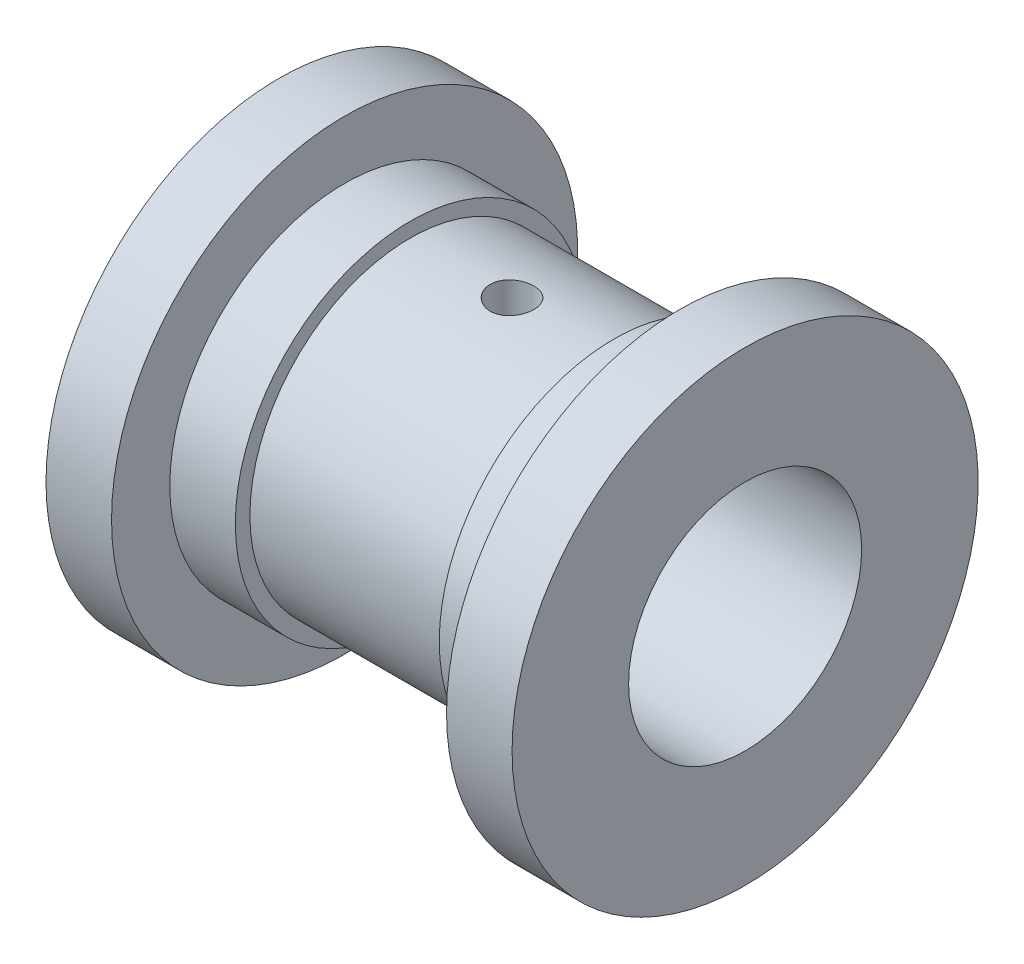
SolidWorks part; units mm, degrees
ref_plane "Front" through (0, 0, 0) normal (0, 0, 1) x (1, 0, 0)
ref_plane "Top" through (0, 0, 0) normal (0, 1, 0) x (1, 0, 0)
ref_plane "Right" through (0, 0, 0) normal (1, 0, 0) x (0, 0, -1)
sketch "Sketch1" plane through (0, 0, 0) normal (0, 0, 1) x (1, 0, 0)
  line L0 (-34.2237, 0) -> (34.9718, 0) construction
  line L1 (-32, 16) -> (-32, 32)
  line L2 (-32, 32) -> (-23, 32)
  line L3 (-23, 32) -> (-23, 24)
  line L4 (-23, 24) -> (-14, 24)
  line L5 (-14, 24) -> (-14, 22)
  line L6 (-14, 22) -> (14, 22)
  line L7 (0, 0) -> (0, 21.1327) construction
  line L8 (14, 24) -> (14, 22)
  line L9 (23, 24) -> (14, 24)
  line L10 (23, 32) -> (23, 24)
  line L11 (32, 32) -> (23, 32)
  line L12 (32, 16) -> (32, 32)
  line L13 (-32, 16) -> (32, 16)
  point P13 (0, 22)
  dimension "D1" = 44
  dimension "D2" = 48
  dimension "D3" = 64
  dimension "D4" = 32
  dimension "D5" = 28
  dimension "D6" = 46
  dimension "D7" = 9
revolve "Revolve1" add sketch "Sketch1" angle 360 about L0
ref_plane "Plane1" through (0, -30, 0) normal (0, 1, 0) x (-1, 0, 0)
sketch "Sketch3" plane through (0, -30, 0) normal (0, 1, 0) x (-1, 0, 0)
  circle A0 centre (0, 0) radius 4
  dimension "D1" = 8
extrude "Extrude1" add sketch "Sketch3" along normal up to next
sketch "Sketch4" plane through (0, -30, 0) normal (0, -1, 0) x (1, 0, 0)
  point P0 (0, 0)
other "Hole1"
sketch "Sketch5" plane through (0, -30, 0) normal (0, -1, 0) x (1, 0, 0)
  circle A0 centre (0, 0) radius 3
  dimension "D1" = 6
